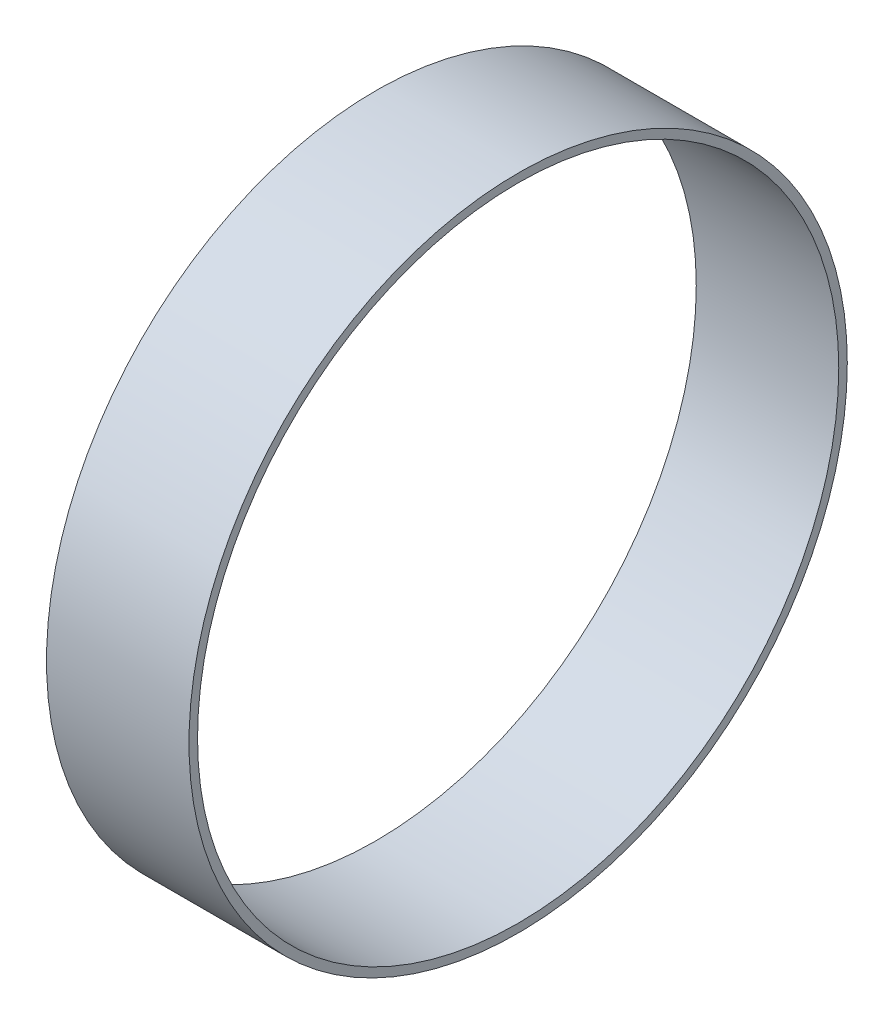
SolidWorks part; units mm, degrees
ref_plane "Спереди" through (0, 0, 0) normal (0, 0, 1) x (1, 0, 0)
ref_plane "Сверху" through (0, 0, 0) normal (0, 1, 0) x (1, 0, 0)
ref_plane "Справа" through (0, 0, 0) normal (1, 0, 0) x (0, 0, -1)
sketch "Эскиз4" plane through (0, 0, 0) normal (1, 0, 0) x (0, 0, -1)
  circle A0 centre (0, 0) radius 22.5
  circle A1 centre (0, 0) radius 23.1
  dimension "D1" = 45
  dimension "D2" = 46.2
extrude "Бобышка-Вытянуть1" add sketch "Эскиз4" along normal blind 10
